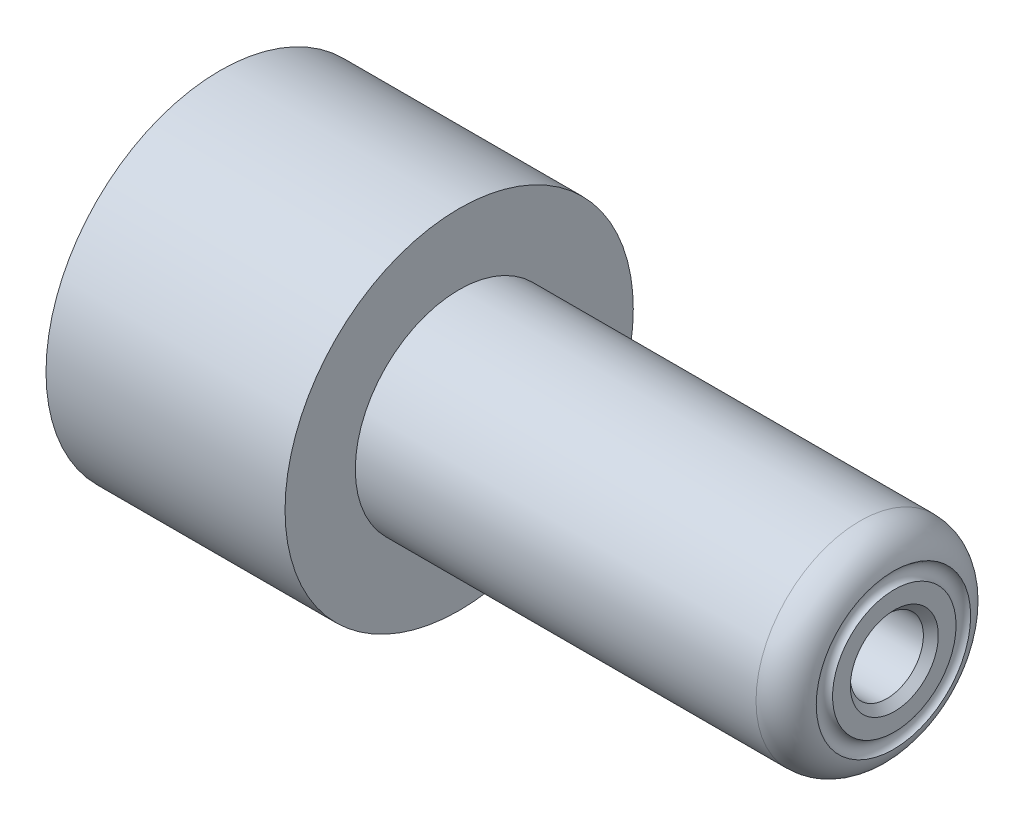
SolidWorks part; units mm, degrees
ref_plane "Front Plane" through (0, 0, 0) normal (0, 0, 1) x (1, 0, 0)
ref_plane "Top Plane" through (0, 0, 0) normal (0, 1, 0) x (1, 0, 0)
ref_plane "Right Plane" through (0, 0, 0) normal (1, 0, 0) x (0, 0, -1)
sketch "Sketch1" plane through (0, 0, 0) normal (0, 0, 1) x (1, 0, 0)
  line L0 (0, 0) -> (102.3864, 0) construction
  line L1 (0, 3.57) -> (0, 7.9375)
  line L2 (0, 7.9375) -> (10.8966, 7.9375)
  line L3 (10.8966, 7.9375) -> (10.8966, 4.735)
  line L4 (10.8966, 4.735) -> (29.164, 4.735)
  line L5 (30.734, 3.165) -> (30.734, 0)
  line L6 (30.734, 0) -> (24.4856, 0)
  line L7 (0, 3.57) -> (24.4856, 3.57)
  line L8 (24.4856, 3.57) -> (24.4856, 0)
  arc A0 (30.734, 3.165) -> (29.164, 4.735) centre (29.164, 3.165) ccw
  dimension "D5" = 1.57
  dimension "D1" = 10.8966
  dimension "D2" = 15.875
  dimension "D3" = 24.4856
  dimension "D4" = 7.14
  dimension "D6" = 30.734
  dimension "D7" = 9.47
revolve "Revolve1" add sketch "Sketch1" angle 360 about L0
sketch "Sketch2" plane through (0, 0, 0) normal (-1, 0, 0) x (0, 0, 1)
  line L0 (0, 0) -> (0, 9.7644) construction
  circle A0 centre (-5.5499, 0) radius 1.18
  circle A1 centre (5.5499, 0) radius 1.18
  dimension "D2" = 2.36
  dimension "D1" = 11.0998
extrude "Cut-Extrude1" cut sketch "Sketch2" against normal blind 2.36
sketch "Sketch3" plane through (30.734, 0, 0) normal (1, 0, 0) x (0, 0, -1)
  circle A0 centre (0, 0) radius 1.665
  dimension "D1" = 3.33
extrude "Cut-Extrude2" cut sketch "Sketch3" against normal through all
chamfer "Chamfer1" distance 0.34 angle 45 1 edges at (30.734, 0, -1.665)
sketch "Sketch4" plane through (0, 0, 0) normal (0, 0, 1) x (1, 0, 0)
  line L0 (0, 0) -> (32.532, 0) construction
  line L1 (30.734, -3.165) -> (30.734, 3.165) construction
  line L3 (0, 7.9375) -> (0, -7.9375) construction
  circle A0 centre (30.857, 3.175) radius 0.381
  dimension "D1" = 0.381
  dimension "D2" = 6.35
  dimension "D4" = 0.123
  dimension "D3" = 30.857
revolve "Cut-Revolve1" cut sketch "Sketch4" angle 360 about L0
